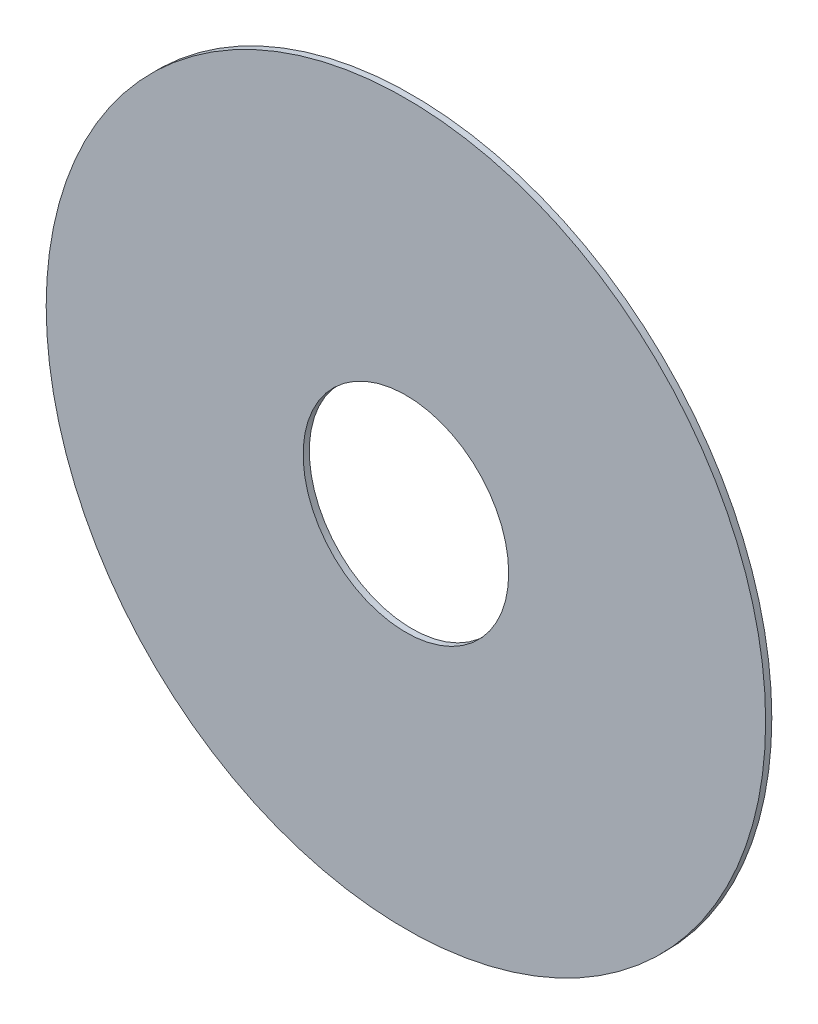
SolidWorks part; units mm, degrees
ref_plane "Front Plane" through (0, 0, 0) normal (0, 0, 1) x (1, 0, 0)
ref_plane "Top Plane" through (0, 0, 0) normal (0, 1, 0) x (1, 0, 0)
ref_plane "Right Plane" through (0, 0, 0) normal (1, 0, 0) x (0, 0, -1)
sketch "Sketch1" plane through (0, 0, 0) normal (0, 0, 1) x (1, 0, 0)
  circle A0 centre (0, 0) radius 88.9
  dimension "D1" = 177.8
extrude "Boss-Extrude1" add sketch "Sketch1" along normal blind 1.524 contours A0
sketch "Sketch2" plane through (0, 0, 1.524) normal (0, 0, 1) x (1, 0, 0)
  circle A0 centre (0, 0) radius 25.4
  dimension "D1" = 50.8
extrude "Cut-Extrude1" cut sketch "Sketch2" against normal blind 1.524 contours A0
